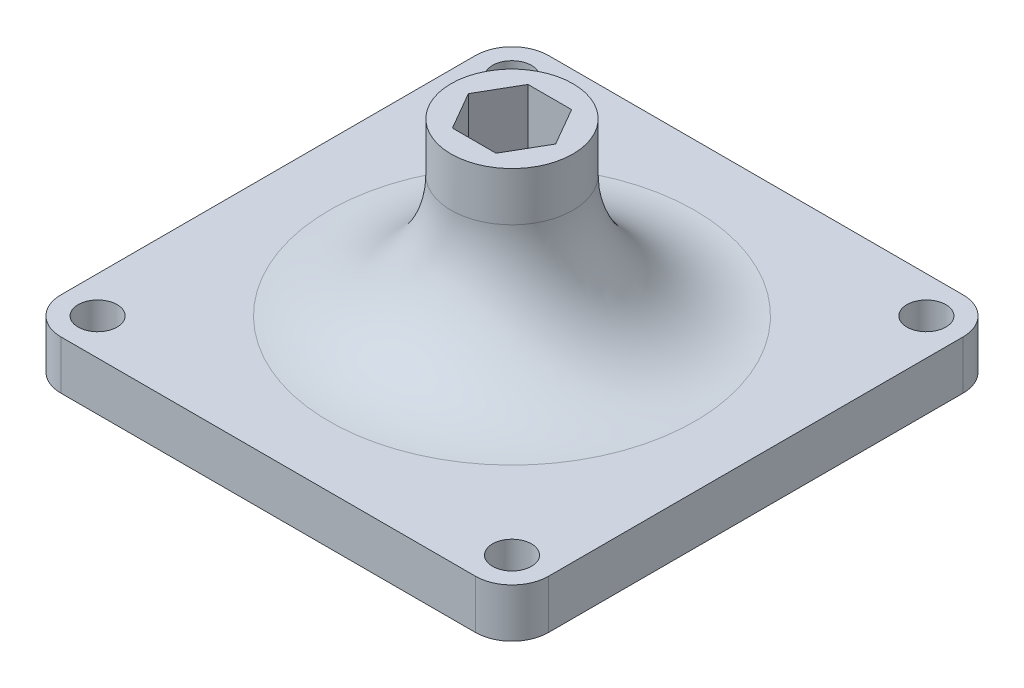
SolidWorks part; units mm, degrees
ref_plane "前视基准面" through (0, 0, 0) normal (0, 0, 1) x (1, 0, 0)
ref_plane "上视基准面" through (0, 0, 0) normal (0, 1, 0) x (1, 0, 0)
ref_plane "右视基准面" through (0, 0, 0) normal (1, 0, 0) x (0, 0, -1)
other "Configuration Table"
sketch "草图1" plane through (0, 0, 0) normal (0, 1, 0) x (1, 0, 0)
  line L0 (-17, 17) -> (17, 17) construction
  line L1 (-17, 17) -> (-17, -17) construction
  line L3 (-17, 20) -> (17, 20)
  line L4 (-20, 17) -> (-20, -17)
  line L5 (-17, -20) -> (17, -20)
  line L6 (20, 17) -> (20, -17)
  circle A0 centre (-17, 17) radius 1.6
  circle A1 centre (17, 17) radius 1.6
  circle A2 centre (17, -17) radius 1.6
  circle A3 centre (-17, -17) radius 1.6
  arc A4 (17, 20) -> (20, 17) centre (17, 17) cw
  arc A5 (17, -20) -> (20, -17) centre (17, -17) ccw
  arc A6 (-20, -17) -> (-17, -20) centre (-17, -17) ccw
  arc A7 (-17, 20) -> (-20, 17) centre (-17, 17) ccw
  dimension "D6" = 3.2
  dimension "D13" = 3
  dimension "D3" = 90
  dimension "D4" = 34
  dimension "D5" = 34
  dimension "D7" = 17
  dimension "D8" = 17
  dimension "D9" = 3
  dimension "D10" = 3
  dimension "D11" = 3
  dimension "D12" = 3
  dimension "D1" = 2
  dimension "D2" = 2
extrude "凸台-拉伸1" add sketch "草图1" along normal blind 4
sketch "草图2" plane through (0, 4, 0) normal (0, 1, 0) x (1, 0, 0)
  circle A0 centre (0, 0) radius 5
  dimension "D1" = 10
extrude "凸台-拉伸2" add sketch "草图2" along normal blind 14
fillet "圆角1" radius 10 1 edges at (0, 4, -5)
sketch "草图3" plane through (0, 18, 0) normal (0, 1, 0) x (1, 0, 0)
  line L1 (3.5796, 0) -> (1.7898, 3.1)
  line L2 (1.7898, 3.1) -> (-1.7898, 3.1)
  line L3 (-1.7898, 3.1) -> (-3.5796, 0)
  line L4 (-3.5796, 0) -> (-1.7898, -3.1)
  line L5 (-1.7898, -3.1) -> (1.7898, -3.1)
  line L6 (1.7898, -3.1) -> (3.5796, 0)
  circle A0 centre (0, 0) radius 3.1 construction
  dimension "D1" = 6.2
extrude "切除-拉伸1" cut sketch "草图3" against normal blind 8
sketch "草图4" plane through (0, 0, 0) normal (0, -1, 0) x (1, 0, 0)
  circle A0 centre (0, 0) radius 3.75
  dimension "D1" = 7.5
extrude "切除-拉伸2" cut sketch "草图4" against normal blind 5
sketch "草图5" plane through (0, 5, 0) normal (0, -1, 0) x (1, 0, 0)
  circle A0 centre (0, 0) radius 2.1
  dimension "D1" = 4.2
extrude "切除-拉伸3" cut sketch "草图5" against normal through all
